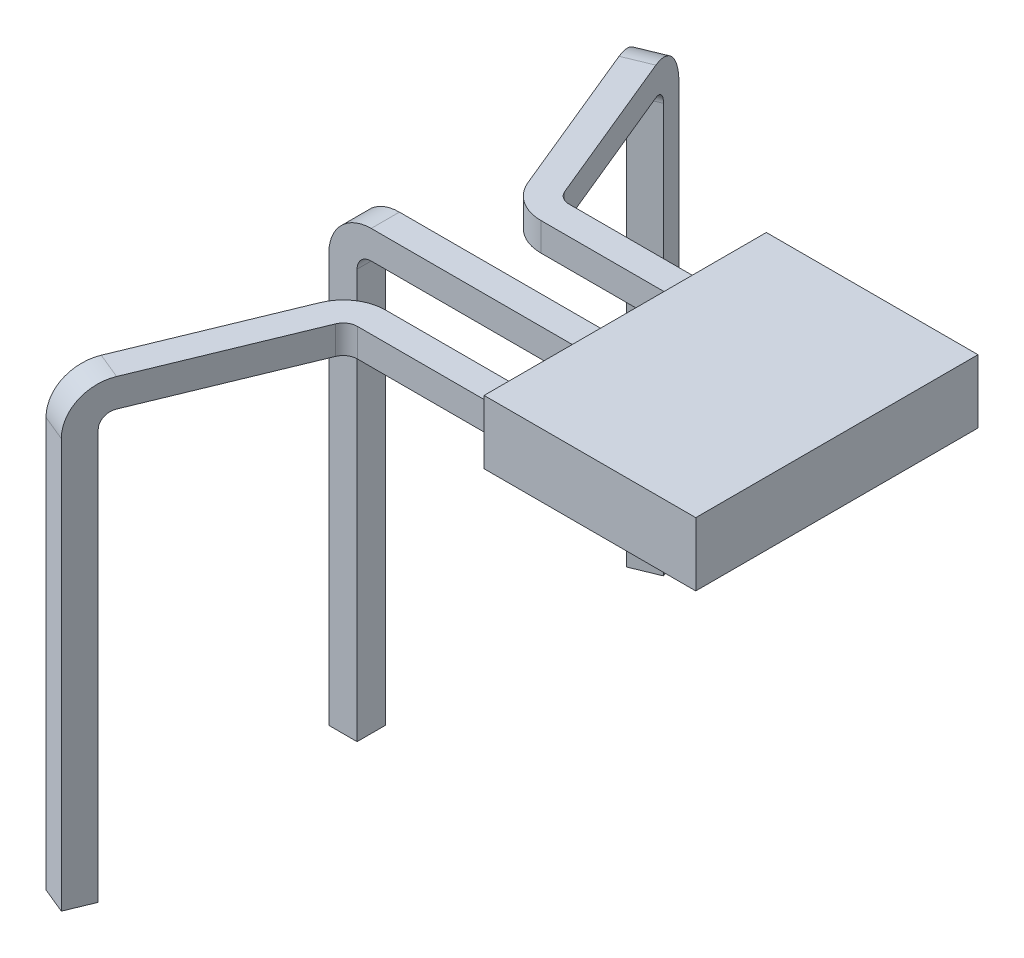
SolidWorks part; units mm, degrees
ref_plane "Plan de face" through (0, 0, 0) normal (0, 0, 1) x (1, 0, 0)
ref_plane "Plan de dessus" through (0, 0, 0) normal (0, 1, 0) x (1, 0, 0)
ref_plane "Plan de droite" through (0, 0, 0) normal (1, 0, 0) x (0, 0, -1)
sketch "Esquisse1" plane through (0, 0, 0) normal (0, 1, 0) x (1, 0, 0)
  line L1 (0, -2) -> (3, -2)
  line L2 (0, -2) -> (0, 2)
  line L3 (0, 2) -> (3, 2)
  line L4 (3, -2) -> (3, 2)
  dimension "D1" = 2
  dimension "D2" = 4
  dimension "D3" = 3
extrude "Extrusion1" add sketch "Esquisse1" along normal blind 1.5
chamfer "Chanfrein1" distance 0.6 angle 45 3 edges at (1.5, 0, -2) (3, 0, 0) (1.5, 0, 2)
ref_plane "Plan1" through (0, 0.75, 0) normal (0, 1, 0) x (-1, 0, 0)
sketch "Esquisse2" plane through (0, 0.75, 0) normal (0, 1, 0) x (-1, 0, 0)
  line L1 (0, 1.3) -> (2.5639, 1.3)
  line L2 (0, -2) -> (0, 2) construction
  line L3 (2.5639, 1.3) -> (3.8, 4.3)
  dimension "D1" = 1.3
  dimension "D2" = 4.3
  dimension "D3" = 3.2447
  dimension "D6" = 3.8
sketch "Esquisse3" plane through (0, 0, 0) normal (-1, 0, 0) x (0, 0, 1)
  line L1 (1.1, 0.95) -> (1.5, 0.95)
  line L2 (1.5, 0.95) -> (1.5, 0.55)
  line L3 (1.5, 0.55) -> (1.1, 0.55)
  line L4 (1.1, 0.55) -> (1.1, 0.95)
  line L14 (-2, 1.5) -> (2, 1.5) construction
  circle A0 centre (1.3, 0.75) radius 0.2 construction
  dimension "D2" = 0.4
  dimension "D5" = 90
sweep "Balayage1" add profiles "Esquisse3" path "Esquisse2"
sketch "Esquisse4" plane through (0, 0.55, 0) normal (0, -1, 0) x (1, 0, 0)
  line L0 (-2.43, 1.5) -> (-3.6151, 4.3762) construction
  line L1 (-3.6151, 4.3762) -> (-3.9849, 4.2238)
  line L2 (-3.9849, 4.2238) -> (-3.8325, 3.854)
  line L3 (-3.8325, 3.854) -> (-3.4627, 4.0064)
  line L4 (-3.4627, 4.0064) -> (-3.6151, 4.3762)
  line L5 (-2.6978, 1.1) -> (-3.9849, 4.2238) construction
  circle A0 centre (-3.7238, 4.1151) radius 0.2 construction
extrude "Extrusion2" add sketch "Esquisse4" along normal blind 6
fillet "Congé1" radius 0.6 2 edges at (-3.8, 0.95, 4.3) (-2.6978, 0.75, 1.1)
fillet "Congé2" radius 0.2 2 edges at (-3.6476, 0.55, 3.9302) (-2.43, 0.75, 1.5)
mirror "Symétrie1" about plane through (0, 0, 0) normal (0, 0, 1) of "Congé2", "Congé1", "Extrusion2", "Balayage1"
sketch "Esquisse6" plane through (0, 0.75, 0) normal (0, 1, 0) x (-1, 0, 0)
  line L0 (0, 0) -> (4, 0)
  dimension "D1" = 4
sketch "Esquisse7" plane through (0, 0, 0) normal (-1, 0, 0) x (0, 0, 1)
  line L0 (-2, 1.5) -> (2, 1.5) construction
  line L1 (-0.2, 0.55) -> (0.2, 0.55)
  line L2 (0.2, 0.55) -> (0.2, 0.95)
  line L3 (0.2, 0.95) -> (-0.2, 0.95)
  line L4 (-0.2, 0.95) -> (-0.2, 0.55)
  circle A0 centre (0, 0.75) radius 0.2 construction
  dimension "D1" = 0.4
  dimension "D2" = 90
sweep "Balayage2" add profiles "Esquisse7" path "Esquisse6"
sketch "Esquisse8" plane through (0, 0.55, 0) normal (0, -1, 0) x (1, 0, 0)
  line L0 (-4, -0.2) -> (0, -0.2) construction
  line L1 (-4, 0.2) -> (-3.6, 0.2)
  line L2 (-4, 0.2) -> (-4, -0.2)
  line L3 (-4, -0.2) -> (-3.6, -0.2)
  line L4 (-3.6, 0.2) -> (-3.6, -0.2)
  dimension "D1" = 0.4
extrude "Extrusion3" add sketch "Esquisse8" along normal blind 6
fillet "Congé3" radius 0.2 1 edges at (-3.6, 0.55, 0)
fillet "Congé4" radius 0.6 1 edges at (-4, 0.95, 0)
